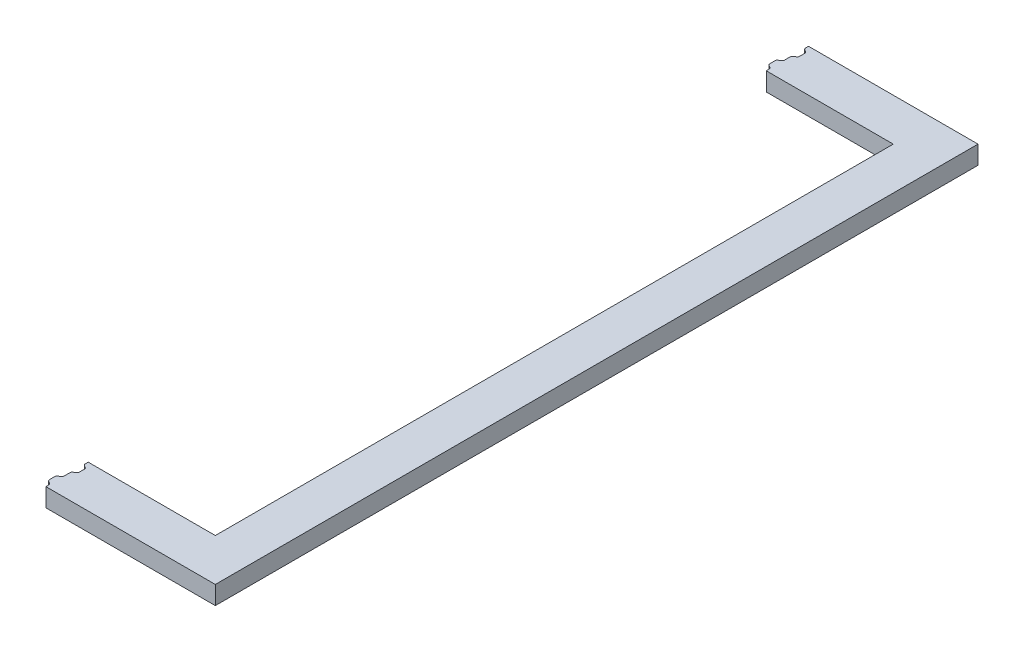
SolidWorks part; units mm, degrees
ref_plane "Face" through (0, 0, 0) normal (0, 0, 1) x (1, 0, 0)
ref_plane "Dessus" through (0, 0, 0) normal (0, 1, 0) x (1, 0, 0)
ref_plane "Droite" through (0, 0, 0) normal (1, 0, 0) x (0, 0, -1)
sketch "Esquisse1" plane through (0, 0, 0) normal (0, 1, 0) x (1, 0, 0)
  line L0 (0, -480.2) -> (0, -482.0762)
  line L1 (0, -19.1048) -> (0, 70.5732) construction
  line L2 (0.8, -483.4619) -> (2.2, -484.2702)
  line L3 (3, -485.6558) -> (3, -489.3396)
  line L4 (2.2022, -490.724) -> (0.7978, -491.5377)
  line L5 (0, -492.9221) -> (0, -497.0779)
  line L6 (0, -509.8) -> (0, -507.9238)
  line L7 (-0.8, -506.5381) -> (-2.2, -505.7298)
  line L8 (-3, -504.3442) -> (-3, -500.6604)
  line L9 (-2.2022, -499.276) -> (-0.7978, -498.4623)
  line L10 (0.2, -480) -> (90, -480)
  line L11 (0.2, -510) -> (120, -510)
  line L12 (120, -510) -> (120, 30)
  line L13 (90, -480) -> (90, 0)
  line L19 (0.2, 30) -> (120, 30)
  line L20 (0.2, 0) -> (90, 0)
  line L21 (1.5, -19.1048) -> (1.5, 42.3436) construction
  line L27 (3, 32.4084) -> (3, -19.1048) construction
  line L32 (0, 29.8) -> (0, 27.9238)
  line L33 (0.8, 26.5381) -> (2.2, 25.7298)
  line L34 (3, 24.3442) -> (3, 20.6604)
  line L35 (2.2022, 19.276) -> (0.7978, 18.4623)
  line L36 (0, 17.0779) -> (0, 12.9221)
  line L37 (0, 0.2) -> (0, 2.0762)
  line L38 (-0.8, 3.4619) -> (-2.2, 4.2702)
  line L39 (-3, 5.6558) -> (-3, 9.3396)
  line L40 (-2.2022, 10.724) -> (-0.7978, 11.5377)
  arc A0 (0, -480.2) -> (0.2, -480) centre (0.2, -480.2) cw
  arc A1 (0, -509.8) -> (0.2, -510) centre (0.2, -509.8) ccw
  arc A2 (0, -482.0762) -> (0.8, -483.4619) centre (1.6, -482.0762) ccw
  arc A3 (2.2, -484.2702) -> (3, -485.6558) centre (1.4, -485.6558) cw
  arc A4 (3, -489.3396) -> (2.2022, -490.724) centre (1.4, -489.3396) cw
  arc A5 (0, 29.8) -> (0.2, 30) centre (0.2, 29.8) cw
  arc A6 (-0.7978, -498.4623) -> (0, -497.0779) centre (-1.6, -497.0779) ccw
  arc A7 (0.7978, -491.5377) -> (0, -492.9221) centre (1.6, -492.9221) ccw
  arc A8 (0, -507.9238) -> (-0.8, -506.5381) centre (-1.6, -507.9238) ccw
  arc A9 (0, 0.2) -> (0.2, 0) centre (0.2, 0.2) ccw
  arc A10 (-2.2, -505.7298) -> (-3, -504.3442) centre (-1.4, -504.3442) cw
  arc A11 (-3, -500.6604) -> (-2.2022, -499.276) centre (-1.4, -500.6604) cw
  arc A16 (0, 27.9238) -> (0.8, 26.5381) centre (1.6, 27.9238) ccw
  arc A17 (2.2, 25.7298) -> (3, 24.3442) centre (1.4, 24.3442) cw
  arc A18 (3, 20.6604) -> (2.2022, 19.276) centre (1.4, 20.6604) cw
  arc A19 (-0.7978, 11.5377) -> (0, 12.9221) centre (-1.6, 12.9221) ccw
  arc A20 (0.7978, 18.4623) -> (0, 17.0779) centre (1.6, 17.0779) ccw
  arc A21 (0, 2.0762) -> (-0.8, 3.4619) centre (-1.6, 2.0762) ccw
  arc A22 (-2.2, 4.2702) -> (-3, 5.6558) centre (-1.4, 5.6558) cw
  arc A23 (-3, 9.3396) -> (-2.2022, 10.724) centre (-1.4, 9.3396) cw
  point P123 (0, 30)
  point P139 (0, 0)
  dimension "D23" = 0.2
  dimension "D3" = 123
  dimension "D4" = 93
  dimension "D5" = 30
  dimension "D15" = 1.5
extrude "Extrusion1" add sketch "Esquisse1" along normal blind 13
